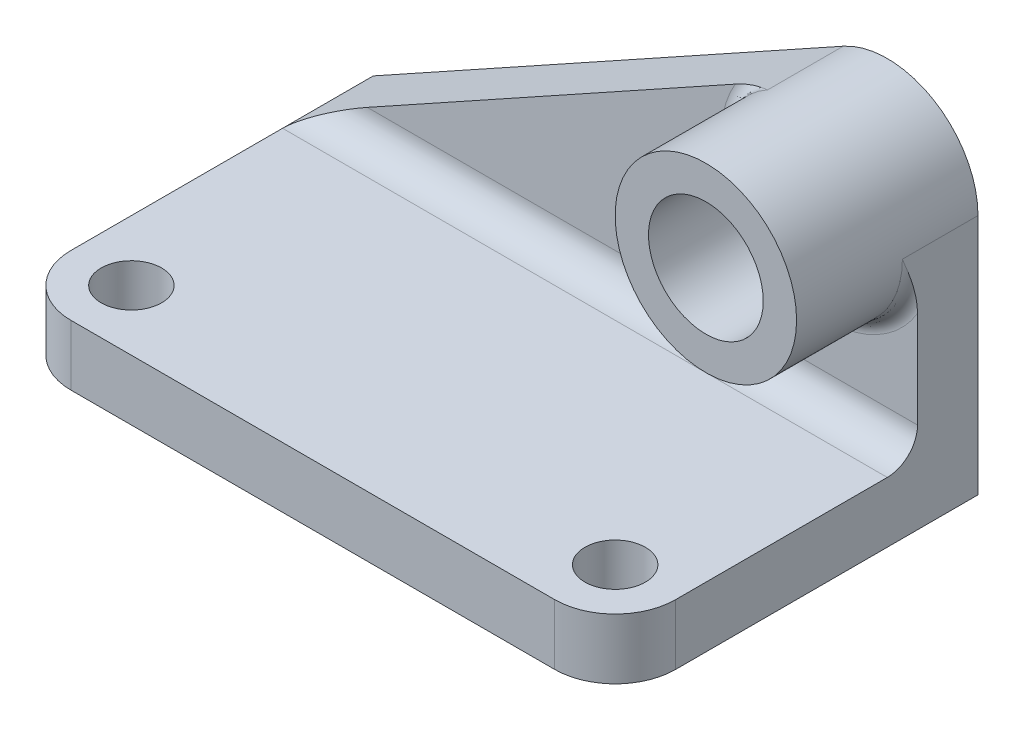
SolidWorks part; units mm, degrees
ref_plane "Front" through (0, 0, 0) normal (0, 0, 1) x (1, 0, 0)
ref_plane "Top" through (0, 0, 0) normal (0, 1, 0) x (1, 0, 0)
ref_plane "Right" through (0, 0, 0) normal (1, 0, 0) x (0, 0, -1)
sketch "Sketch2" plane through (0, 0, 0) normal (0, 1, 0) x (1, 0, 0)
  line L1 (0, 0) -> (-127, 0)
  line L2 (0, 0) -> (0, -76.2)
  line L3 (0, -76.2) -> (-127, -76.2)
  line L4 (-127, 0) -> (-127, -76.2)
  dimension "D1" = 76.2
  dimension "D2" = 127
extrude "Base-Extrude" add sketch "Sketch2" along normal blind 12.7
sketch "Sketch3" plane through (0, 0, 0) normal (0, 0, -1) x (-1, 0, 0)
  line L0 (0, 12.7) -> (0, 50.8)
  line L1 (28.2912, 67.4584) -> (127, 12.7)
  line L2 (127, 12.7) -> (0, 12.7)
  arc A0 (0, 50.8) -> (28.2912, 67.4584) centre (19.05, 50.8) cw
  dimension "D1" = 19.05
  dimension "D2" = 38.1
extrude "Boss-Extrude1" add sketch "Sketch3" against normal blind 12.7
fillet "Fillet1" radius 12.7
sketch "Sketch4" plane through (0, 0, 12.7) normal (0, 0, 1) x (1, 0, 0)
  circle A0 centre (-19.05, 50.8) radius 19.05
  arc A1 (0, 50.8) -> (-28.2912, 67.4584) centre (-19.05, 50.8) ccw construction
extrude "Boss-Extrude2" add sketch "Sketch4" along normal blind 25.4
fillet "Fillet2" radius 3.175
fillet "Fillet4" radius 6.35
sketch "Sketch5" plane through (0, 12.7, 0) normal (0, 1, 0) x (-1, 0, 0)
  line L0 (63.5, 76.2) -> (63.5, 31.0484) construction
  line L1 (114.3, 76.2) -> (12.7, 76.2) construction
  circle A0 centre (12.7, 63.5) radius 6.35
  circle A1 centre (114.3, 63.5) radius 6.35
  arc A2 (12.7, 76.2) -> (0, 63.5) centre (12.7, 63.5) ccw construction
  dimension "D1" = 12.7
extrude "Cut-Extrude1" cut sketch "Sketch5" against normal through all
sketch "Sketch6" plane through (0, 0, 38.1) normal (0, 0, 1) x (1, 0, 0)
  circle A0 centre (-19.05, 50.8) radius 12.0489
extrude "Cut-Extrude2" cut sketch "Sketch6" against normal through all
